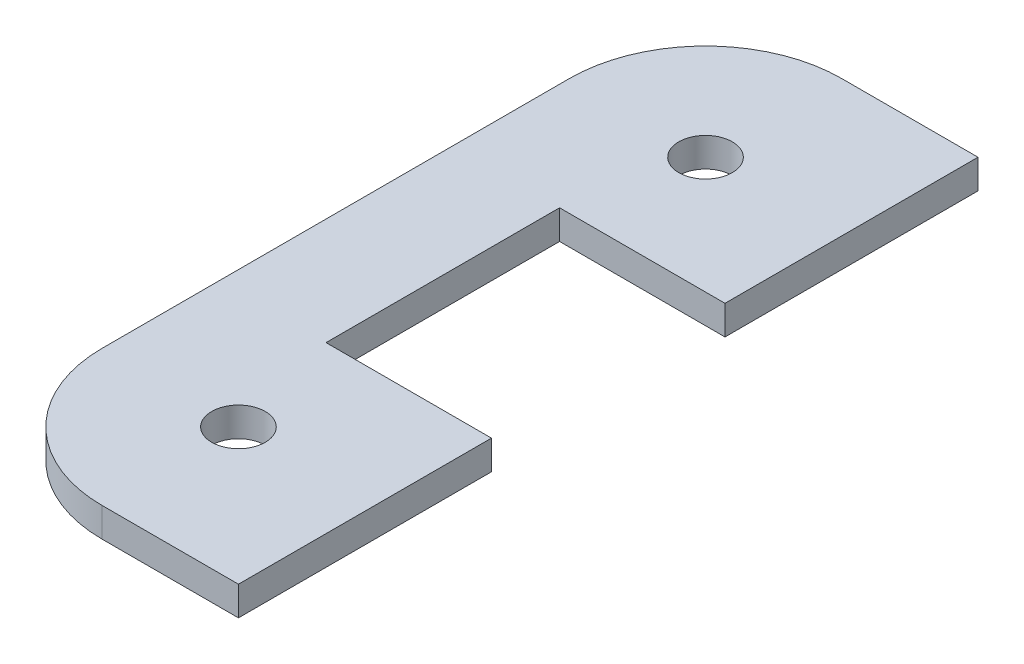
SolidWorks part; units mm, degrees
ref_plane "Front Plane" through (0, 0, 0) normal (0, 0, 1) x (1, 0, 0)
ref_plane "Top Plane" through (0, 0, 0) normal (0, 1, 0) x (1, 0, 0)
ref_plane "Right Plane" through (0, 0, 0) normal (1, 0, 0) x (0, 0, -1)
sketch "Sketch1" plane through (0, 0, 0) normal (0, 1, 0) x (1, 0, 0)
  line L0 (28, 50) -> (28, 76)
  line L1 (14, 0) -> (28, 0)
  line L2 (0, 14) -> (0, 62)
  line L3 (14, 76) -> (28, 76)
  line L4 (28, 0) -> (28, 26)
  line L5 (28, 50) -> (11, 50)
  line L7 (28, 26) -> (11, 26)
  line L8 (11, 50) -> (11, 26)
  arc A0 (0, 62) -> (14, 76) centre (14, 62) cw
  arc A1 (14, 0) -> (0, 14) centre (14, 14) cw
  circle A2 centre (14, 62) radius 2.75
  circle A3 centre (14, 14) radius 2.75
  point P7 (0, 76)
  point P10 (0, 0)
  dimension "D3" = 14
  dimension "D7" = 5.5
  dimension "D1" = 28
  dimension "D2" = 76
  dimension "D4" = 26
  dimension "D5" = 26
  dimension "D6" = 17
extrude "Extrude1" add sketch "Sketch1" along normal blind 3
